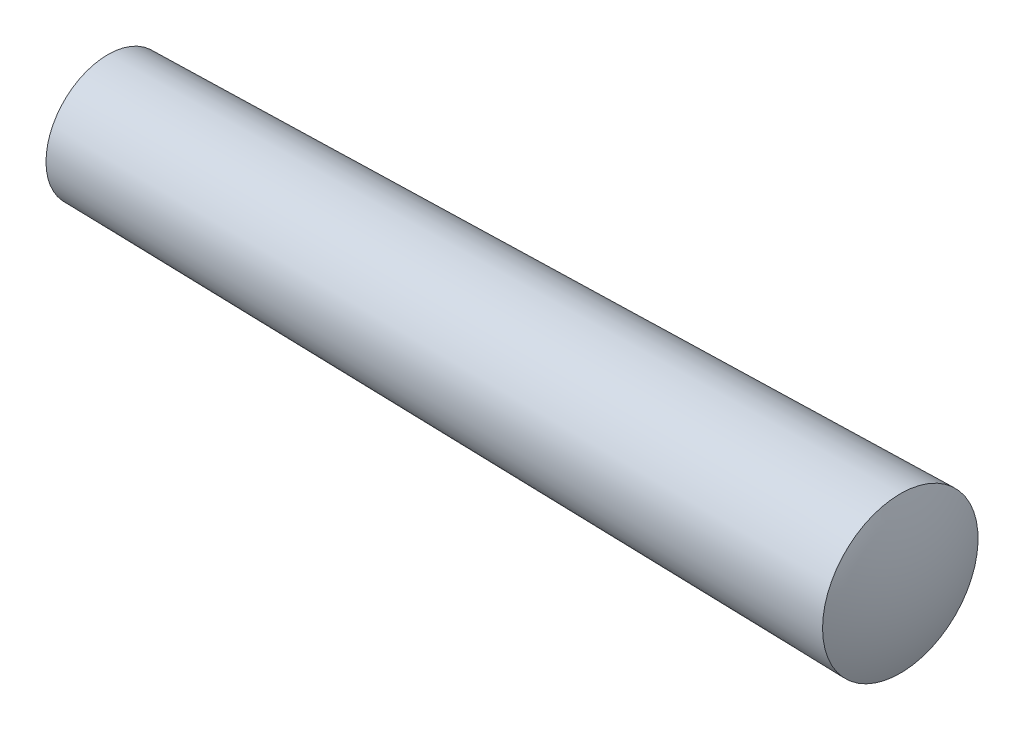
SolidWorks part; units mm, degrees
ref_plane "Front" through (0, 0, 0) normal (0, 0, 1) x (1, 0, 0)
ref_plane "Top" through (0, 0, 0) normal (0, 1, 0) x (1, 0, 0)
ref_plane "Right" through (0, 0, 0) normal (1, 0, 0) x (0, 0, -1)
sketch "Sketch1" plane through (0, 0, 0) normal (0, 0, 1) x (1, 0, 0)
  line L0 (0, 0) -> (4, 0)
  line L1 (0.08, 0.3) -> (3.92, 0.3) construction
  line L2 (3.92, 0.3) -> (3.92, 0.3768) construction
  line L3 (0.08, 0.3) -> (3.92, 0.3768)
  line L4 (-4.0035, 0) -> (8.3584, 0) construction
  line L5 (4, 0) -> (4, -0.7875) construction
  line L6 (0, 0) -> (0, -0.8153) construction
  arc A0 (0.08, 0.3) -> (0, 0) centre (0.6025, 0) ccw
  arc A1 (4, 0) -> (3.92, 0.3768) centre (3.0726, 0) ccw
  dimension "l" = 4
  dimension "D5" = 0.0768
  dimension "a" = 0.08
  dimension "d" = 0.6
  dimension "a1" = 0.08
revolve "Base-Revolve" add sketch "Sketch1" angle 360 about L4
equation "\"D5@Sketch1\" = ( \"l@Sketch1\"-2*\"a@Sketch1\")/ 50"
equation "\"a1@Sketch1\" = \"a@Sketch1\""
